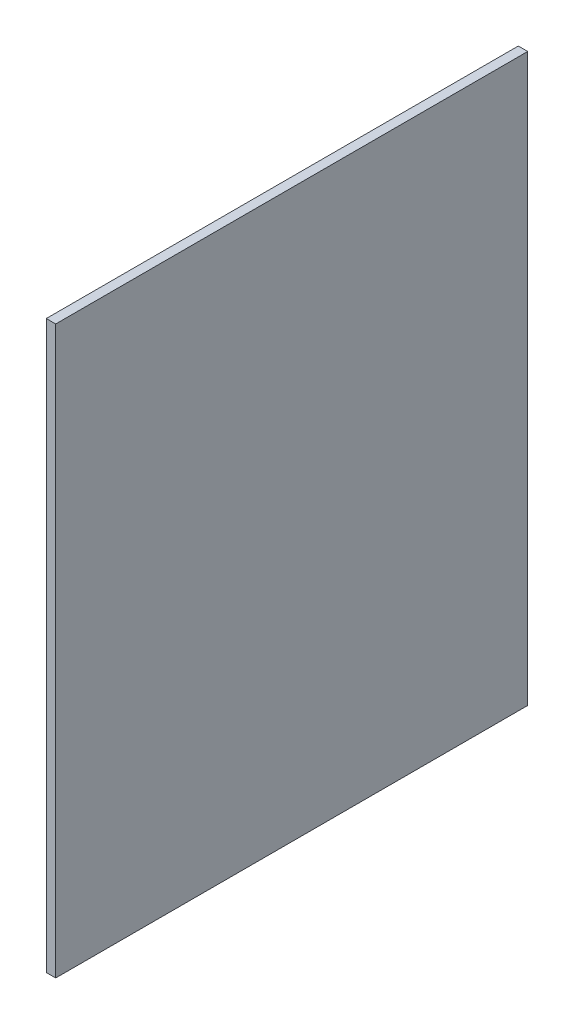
SolidWorks part; units mm, degrees
ref_plane "Plan de face" through (0, 0, 0) normal (0, 0, 1) x (1, 0, 0)
ref_plane "Plan de dessus" through (0, 0, 0) normal (0, 1, 0) x (1, 0, 0)
ref_plane "Plan de droite" through (0, 0, 0) normal (1, 0, 0) x (0, 0, -1)
sketch "Esquisse1" plane through (0, 0, 0) normal (0, 0, 1) x (1, 0, 0)
  line L1 (-50.5375, 299.7316) -> (-44.5375, 299.7316)
  line L2 (-50.5375, 299.7316) -> (-50.5375, -60.2684)
  line L3 (-50.5375, -60.2684) -> (-44.5375, -60.2684)
  line L4 (-44.5375, 299.7316) -> (-44.5375, -60.2684)
  dimension "D1" = 6
  dimension "D2" = 360
extrude "Extrusion1" add sketch "Esquisse1" along normal blind 300
